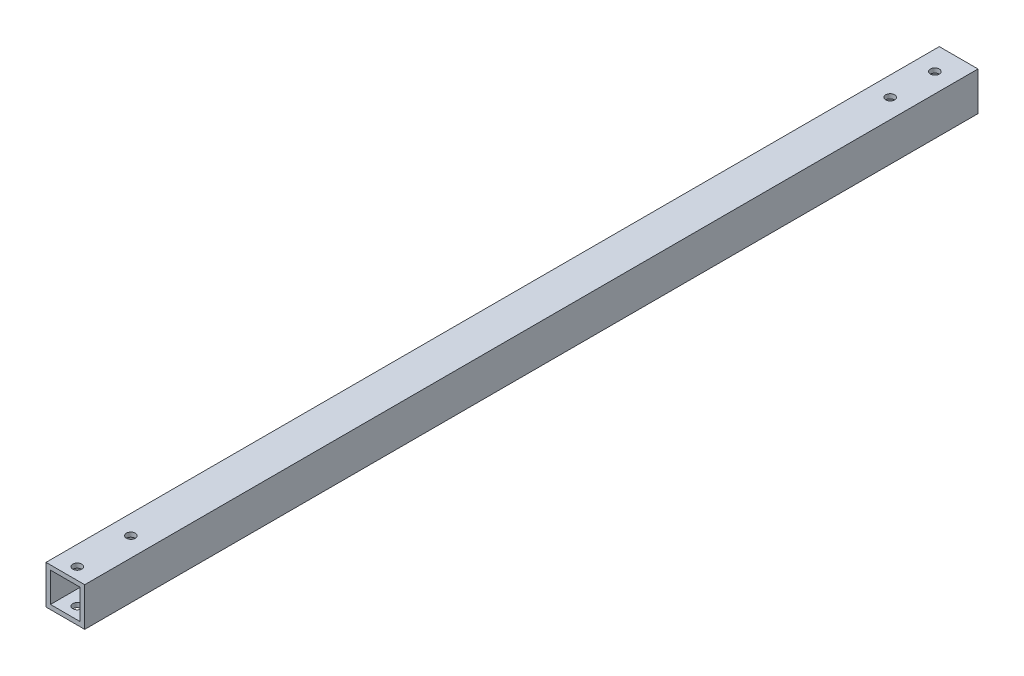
SolidWorks part; units mm, degrees
ref_plane "Спереди" through (0, 0, 0) normal (0, 0, 1) x (1, 0, 0)
ref_plane "Сверху" through (0, 0, 0) normal (0, 1, 0) x (1, 0, 0)
ref_plane "Справа" through (0, 0, 0) normal (1, 0, 0) x (0, 0, -1)
sketch "Эскиз1" plane through (0, 0, 0) normal (0, 0, 1) x (1, 0, 0)
  line L1 (-6.5, 6.5) -> (6.5, 6.5)
  line L2 (-6.5, 6.5) -> (-6.5, -6.5)
  line L3 (-6.5, -6.5) -> (6.5, -6.5)
  line L4 (6.5, 6.5) -> (6.5, -6.5)
  line L5 (-6.5, 6.5) -> (6.5, -6.5) construction
  line L6 (-6.5, -6.5) -> (6.5, 6.5) construction
  point P0 (0, 0)
  dimension "D1" = 13
  dimension "D2" = 13
extrude "Бобышка-Вытянуть1" add sketch "Эскиз1" along normal blind 300
shell "Оболочка1" thickness 1.5
sketch "Эскиз2" plane through (0, 6.5, 0) normal (0, 1, 0) x (1, 0, 0)
  line L0 (6.5, 0) -> (-6.5, 0) construction
  line L1 (6.5, -300) -> (-6.5, -300) construction
  circle A0 centre (0, -8) radius 1.5
  circle A1 centre (0, -23) radius 1.5
  circle A2 centre (0, -296) radius 1.5
  circle A3 centre (0, -278) radius 1.5
  dimension "D1" = 8
  dimension "D2" = 15
  dimension "D3" = 4
  dimension "D4" = 18
extrude "Вырез-Вытянуть1" cut sketch "Эскиз2" against normal through all
